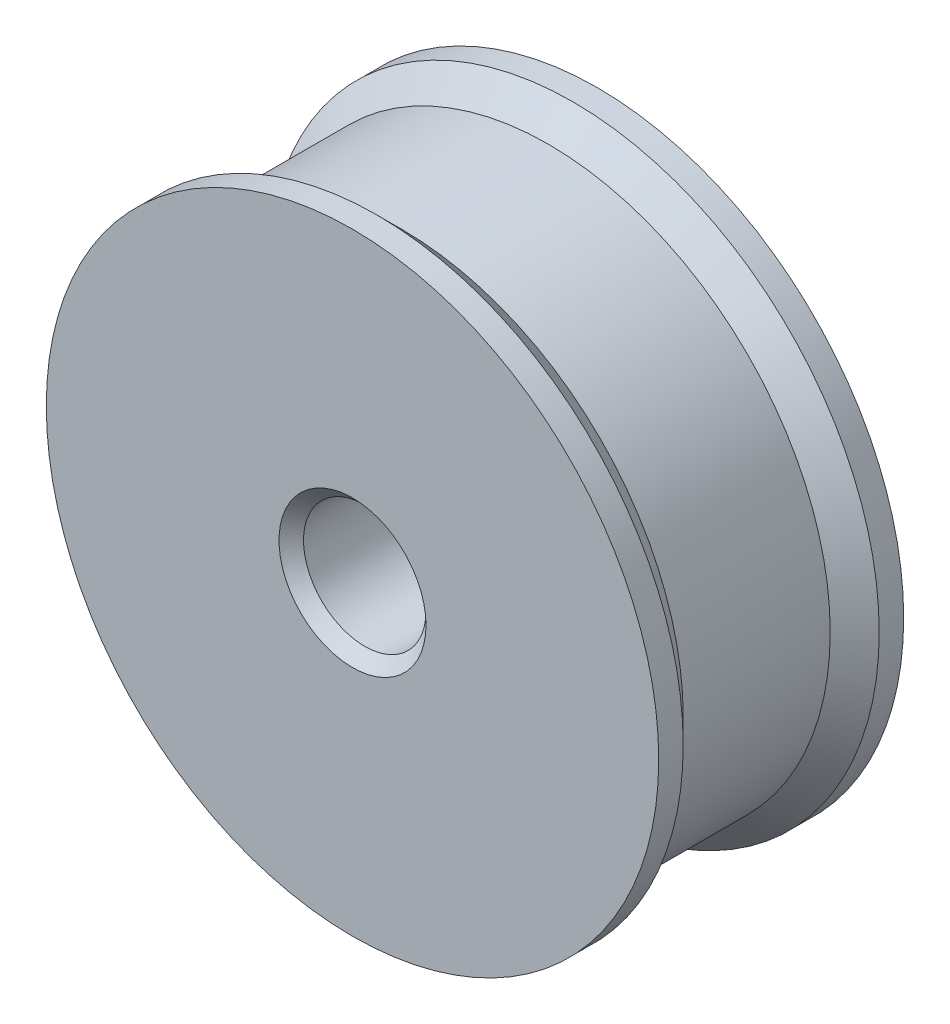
SolidWorks part; units mm, degrees
ref_plane "Ön Düzlem" through (0, 0, 0) normal (0, 0, 1) x (1, 0, 0)
ref_plane "Üst Düzlem" through (0, 0, 0) normal (0, 1, 0) x (1, 0, 0)
ref_plane "Sağ Düzlem" through (0, 0, 0) normal (1, 0, 0) x (0, 0, -1)
sketch "Çizim1" plane through (0, 0, 0) normal (0, 0, 1) x (1, 0, 0)
  circle A0 centre (0, 0) radius 12.5
  circle A1 centre (0, 0) radius 2.5
  dimension "D1" = 25
  dimension "D2" = 5
extrude "Yükseklik-Ekstrüzyon1" add sketch "Çizim1" along normal blind 10
chamfer "Pah1" distance 0.5 angle 45 2 edges at (2.5, 0, 0) (2.5, 0, 10)
sketch "Çizim2" plane through (0, 0, 0) normal (0, 1, 0) x (1, 0, 0)
  line L0 (12.5, -10) -> (12.5, 0) construction
  line L1 (12.5, -1) -> (11.5, -1)
  line L2 (12.5, -1) -> (12.5, -9)
  line L3 (12.5, -9) -> (11.5, -9)
  line L4 (11.5, -1) -> (11.5, -9)
  line L5 (12.5, 0) -> (-12.5, 0) construction
  line L6 (-12.5, -10) -> (12.5, -10) construction
  line L7 (0, 3.4751) -> (0, -12.6659) construction
  dimension "D1" = 1
  dimension "D2" = 1
  dimension "D3" = 1
  dimension "D4" = 8
revolve "Kes-Döndür1" cut sketch "Çizim2" angle 360 about L7
chamfer "Pah2" distance 1 angle 45 2 edges at (-11.5, 0, 9) (-11.5, 0, 1)
